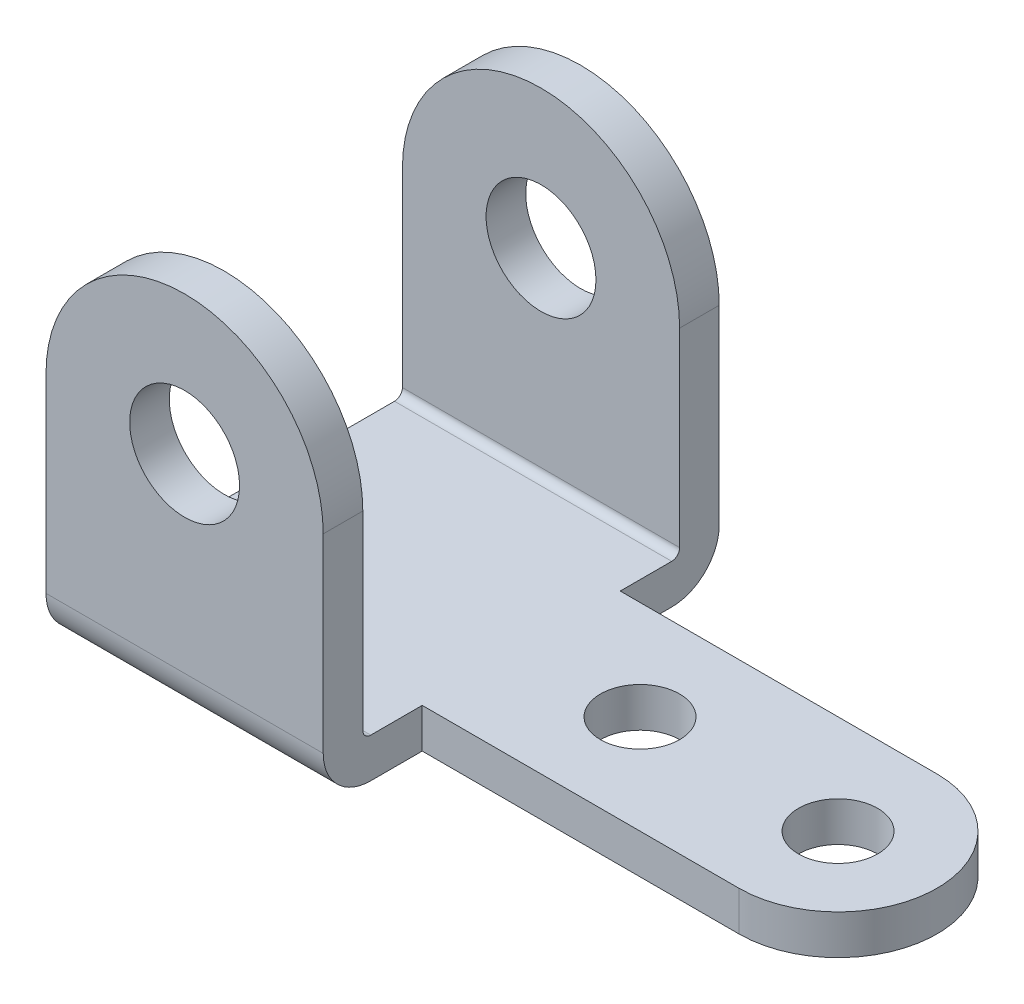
SolidWorks part; units mm, degrees
ref_plane "Front" through (0, 0, 0) normal (0, 0, 1) x (1, 0, 0)
ref_plane "Top" through (0, 0, 0) normal (0, 1, 0) x (1, 0, 0)
ref_plane "Right" through (0, 0, 0) normal (1, 0, 0) x (0, 0, -1)
sketch "Sketch4" plane through (0, 0, 0) normal (0, 0, 1) x (1, 0, 0)
  line L0 (-35, 0) -> (-35, -60)
  line L1 (-35, -60) -> (35, -60)
  line L2 (35, -60) -> (35, 0)
  arc A0 (35, 0) -> (-35, 0) centre (0, 0) ccw
  dimension "D1" = 35
  dimension "D2" = 60
extrude "\"U\" shape" add sketch "Sketch4" along normal blind 100
fillet "Fillet" radius 12 2 edges at (0, -60, 100) (0, -60, 0)
shell "Thickness" thickness 10
sketch "Sketch8" plane through (0, 0, 100) normal (0, 0, 1) x (1, 0, 0)
  circle A0 centre (0, 0) radius 13.8707
  dimension "D1" = 27.7413
extrude "Inner Hole" cut sketch "Sketch8" against normal through all
sketch "Sketch7" plane through (0, -60, 0) normal (0, -1, 0) x (1, 0, 0)
  line L0 (-35, 50) -> (199.2675, 50) construction
  line L1 (35, 25) -> (115, 25)
  line L2 (35, 75) -> (115, 75)
  line L3 (35, 25) -> (35, 75)
  line L4 (-35, 88) -> (-35, 12) construction
  line L5 (35, 88) -> (35, 12) construction
  arc A0 (115, 25) -> (115, 75) centre (115, 50) ccw
  dimension "D2" = 25
  dimension "D1" = 80
extrude "Tongue" add sketch "Sketch7" against normal up to surface (10 mm away)
sketch "Sketch9" plane through (0, -60, 0) normal (0, -1, 0) x (1, 0, 0)
  line L0 (-35, 50) -> (169.8623, 50) construction
  line L1 (-35, 88) -> (-35, 12) construction
  circle A0 centre (65, 50) radius 10
  arc A1 (115, 25) -> (115, 75) centre (115, 50) ccw construction
  circle A2 centre (115, 50) radius 10
  dimension "D1" = 20
  dimension "D2" = 50
extrude "Mounting Holes" cut sketch "Sketch9" against normal through all
